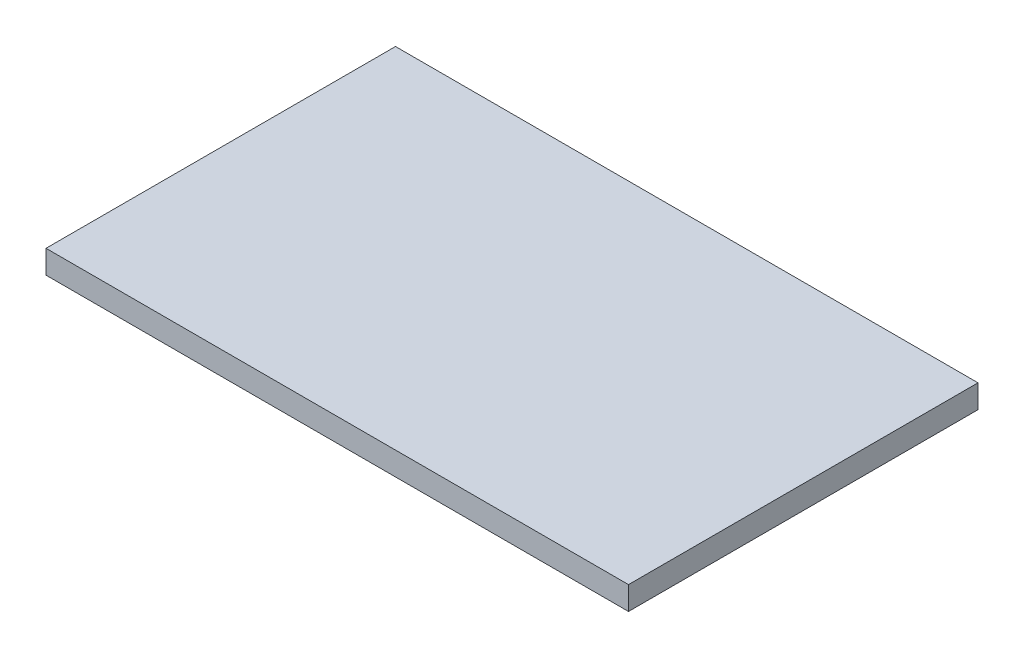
SolidWorks part; units mm, degrees
ref_plane "Front Plane" through (0, 0, 0) normal (0, 0, 1) x (1, 0, 0)
ref_plane "Top Plane" through (0, 0, 0) normal (0, 1, 0) x (1, 0, 0)
ref_plane "Right Plane" through (0, 0, 0) normal (1, 0, 0) x (0, 0, -1)
sketch "Sketch1" plane through (0, 0, 0) normal (0, 1, 0) x (1, 0, 0)
  line L1 (0, 0) -> (100, 0)
  line L2 (0, 0) -> (0, 60)
  line L3 (0, 60) -> (100, 60)
  line L4 (100, 0) -> (100, 60)
  dimension "D1" = 100
  dimension "D2" = 60
extrude "Extrude1" add sketch "Sketch1" along normal blind 4
